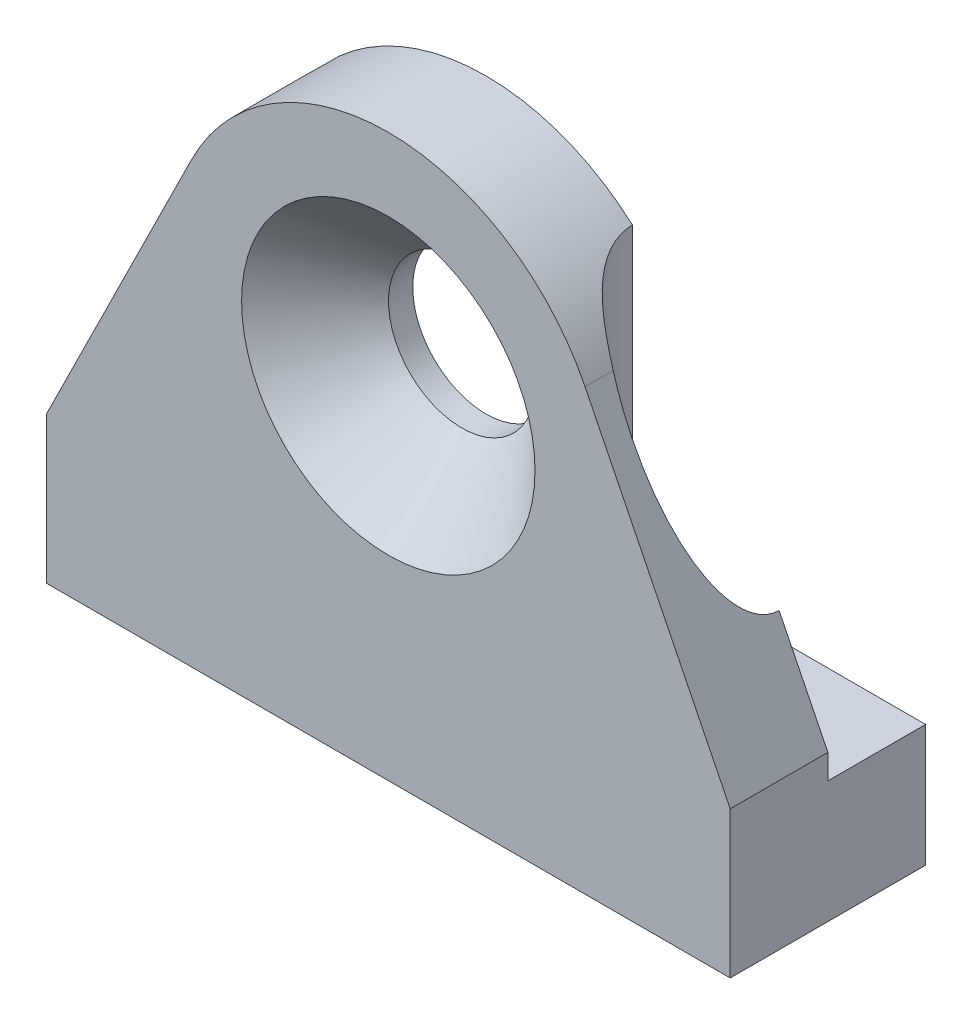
SolidWorks part; units mm, degrees
ref_plane "Front Plane" through (0, 0, 0) normal (0, 0, 1) x (1, 0, 0)
ref_plane "Top Plane" through (0, 0, 0) normal (0, 1, 0) x (1, 0, 0)
ref_plane "Right Plane" through (0, 0, 0) normal (1, 0, 0) x (0, 0, -1)
sketch "Sketch1" plane through (0, 0, 0) normal (0, 0, 1) x (1, 0, 0)
  line L0 (-22.225, -22.225) -> (22.225, -22.225)
  line L1 (22.225, -22.225) -> (22.225, -12.7)
  line L2 (22.225, -12.7) -> (12.7904, 6.3384)
  line L3 (-12.7904, 6.3384) -> (-22.225, -12.7)
  line L4 (-22.225, -12.7) -> (-22.225, -22.225)
  line L5 (0, 0) -> (0, -8.8524) construction
  line L6 (-14.2875, -22.225) -> (-14.2875, 3.3174)
  line L7 (14.2875, -22.225) -> (14.2875, 3.3174)
  line L8 (-22.225, -14.3002) -> (22.225, -14.3002)
  circle A0 centre (0, 0) radius 4.7625
  arc A1 (12.7904, 6.3384) -> (-12.7904, 6.3384) centre (0, 0) ccw
  dimension "D1" = 9.525
  dimension "D4" = 14.2748
  dimension "D2" = 44.45
  dimension "D3" = 22.225
  dimension "D5" = 9.525
  dimension "D6" = 28.575
  dimension "D10" = 7.9248
sketch "Sketch2" plane through (0, 0, 0) normal (0, 0, 1) x (1, 0, 0)
  line L0 (-22.225, -22.225) -> (22.225, -22.225) construction
  line L1 (22.225, -22.225) -> (22.225, -12.7) construction
  line L2 (22.225, -12.7) -> (12.7904, 6.3384) construction
  line L3 (-12.7904, 6.3384) -> (-22.225, -12.7) construction
  line L4 (-22.225, -12.7) -> (-22.225, -22.225) construction
  line L5 (-22.225, -22.225) -> (22.225, -22.225)
  line L6 (22.225, -22.225) -> (22.225, -12.7)
  line L7 (22.225, -12.7) -> (12.7904, 6.3384)
  line L8 (-12.7904, 6.3384) -> (-22.225, -12.7)
  line L9 (-22.225, -12.7) -> (-22.225, -22.225)
  arc A0 (12.7904, 6.3384) -> (-12.7904, 6.3384) centre (0, 0) ccw construction
  circle A1 centre (0, 0) radius 4.7625 construction
  arc A2 (12.7904, 6.3384) -> (-12.7904, 6.3384) centre (0, 0) ccw
  circle A3 centre (0, 0) radius 4.7625
extrude "Boss-Extrude1" add sketch "Sketch2" along normal mid plane 12.7
sketch "Sketch6" plane through (0, 0, 0) normal (0, 0, 1) x (1, 0, 0)
  line L2 (-22.225, -14.3002) -> (22.225, -14.3002) construction
  line L3 (-12.7904, 6.3384) -> (-22.225, -12.7) construction
  line L4 (-22.225, -12.7) -> (-22.225, -22.225) construction
  line L5 (-22.225, -14.3002) -> (22.225, -14.3002)
  line L6 (22.225, -22.225) -> (22.225, -12.7) construction
  line L7 (22.225, -12.7) -> (12.7904, 6.3384) construction
  line L8 (-12.7904, 6.3384) -> (-22.225, -12.7)
  line L9 (-22.225, -12.7) -> (-22.225, -14.3002)
  line L10 (22.225, -14.3002) -> (22.225, -12.7)
  line L11 (22.225, -12.7) -> (12.7904, 6.3384)
  arc A0 (12.7904, 6.3384) -> (-12.7904, 6.3384) centre (0, 0) ccw construction
  circle A1 centre (0, 0) radius 4.7625 construction
  arc A2 (12.7904, 6.3384) -> (-12.7904, 6.3384) centre (0, 0) ccw
  circle A3 centre (0, 0) radius 4.7625
sketch "Sketch3" plane through (0, -22.225, 0) normal (0, -1, 0) x (1, 0, 0)
  circle A0 centre (-14.2875, 0) radius 3.175
  circle A1 centre (14.2875, 0) radius 3.175
  dimension "D1" = 6.35
extrude "Cut-Extrude1" cut sketch "Sketch3" against normal blind 50.8
sketch "Sketch4" plane through (0, -22.225, 0) normal (0, -1, 0) x (1, 0, 0)
  circle A0 centre (-14.2875, 0) radius 4.7625
  circle A1 centre (14.2875, 0) radius 4.7625
  dimension "D1" = 9.525
extrude "Cut-Extrude2" cut sketch "Sketch4" against normal blind 50.8 from offset 6.35
extrude "Cut-Extrude6" cut sketch "Sketch6" against normal blind 25.4
chamfer "Chamfer1" distance 4.7752 angle 45 1 edges at (4.7625, 0, 6.35)
